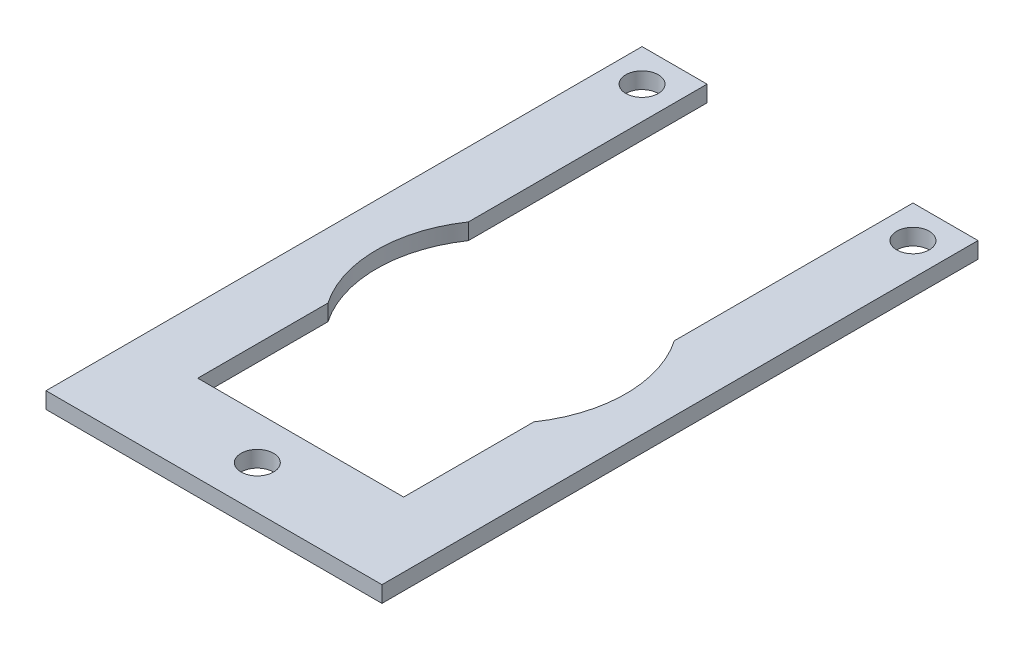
SolidWorks part; units mm, degrees
ref_plane "Front" through (0, 0, 0) normal (0, 0, 1) x (1, 0, 0)
ref_plane "Top" through (0, 0, 0) normal (0, 1, 0) x (1, 0, 0)
ref_plane "Right" through (0, 0, 0) normal (1, 0, 0) x (0, 0, -1)
sketch "Sketch1" plane through (0, 0, 0) normal (0, 1, 0) x (1, 0, 0)
  line L0 (50, 65.9615) -> (50, 110)
  line L1 (0, 0) -> (62, 0)
  line L2 (0, 0) -> (0, 110)
  line L3 (0, 110) -> (12, 110)
  line L4 (62, 0) -> (62, 110)
  line L5 (12, 16) -> (50, 16)
  line L6 (12, 65.9615) -> (12, 110)
  line L8 (50, 110) -> (62, 110)
  line L9 (50, 16) -> (50, 40.0385)
  line L11 (12, 16) -> (12, 40.0385)
  circle A0 centre (6, 104) radius 3
  circle A1 centre (56, 104) radius 3
  circle A2 centre (31, 8) radius 3
  arc A3 (12, 65.9615) -> (12, 40.0385) centre (31, 53) ccw
  arc A4 (50, 40.0385) -> (50, 65.9615) centre (31, 53) ccw
extrude "Extrude1" add sketch "Sketch1" along normal blind 3
